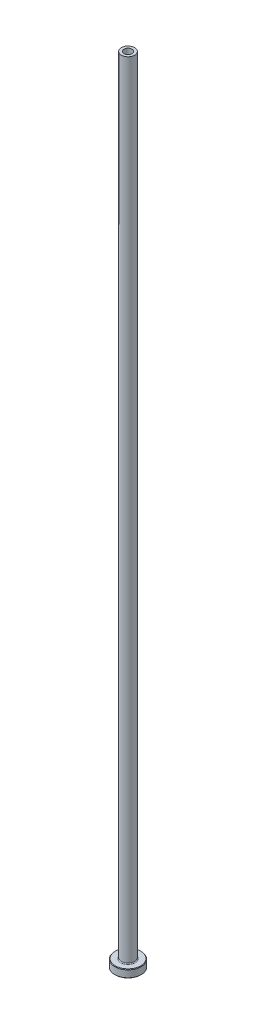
SolidWorks part; units mm, degrees
ref_plane "Front Plane" through (0, 0, 0) normal (0, 0, 1) x (1, 0, 0)
ref_plane "Top Plane" through (0, 0, 0) normal (0, 1, 0) x (1, 0, 0)
ref_plane "Right Plane" through (0, 0, 0) normal (1, 0, 0) x (0, 0, -1)
sketch "Sketch1" plane through (0, 0, 0) normal (0, 0, 1) x (1, 0, 0)
  line L0 (-1.5, 300) -> (-2.5, 300)
  line L1 (-2.5, 300) -> (-2.5, 3)
  line L2 (-2.5, 3) -> (-5, 3)
  line L3 (-5, 3) -> (-5, 0)
  line L4 (5.5, 0) -> (-5.5, 0) construction
  line L5 (-5, 0) -> (-1.75, 0)
  line L6 (-1.5, 255) -> (-1.5, 300)
  line L7 (0, 92.1877) -> (0, -15.5353) construction
  line L8 (0, -5.5) -> (0, 5.5) construction
  line L9 (-1.5, 255) -> (-1.75, 243)
  line L10 (-1.75, 243) -> (-1.75, 0)
  dimension "D1" = 0.25
  dimension "ID" = 3
  dimension "OD" = 5
  dimension "L" = 300
  dimension "H" = 10
  dimension "T" = 3
  dimension "N" = 45
  dimension "D2" = 12
revolve "Revolve1" add sketch "Sketch1" angle 360 about L7
fillet "Fillet1" radius 0.3 1 edges at (0, 3, 2.5)
chamfer "Chamfer1" distance 0.2 angle 45 2 edges at (0, 3, 5) (0, 0, 5)
chamfer "Chamfer3" distance 0.5 angle 45 1 edges at (0, 0, 1.75)
